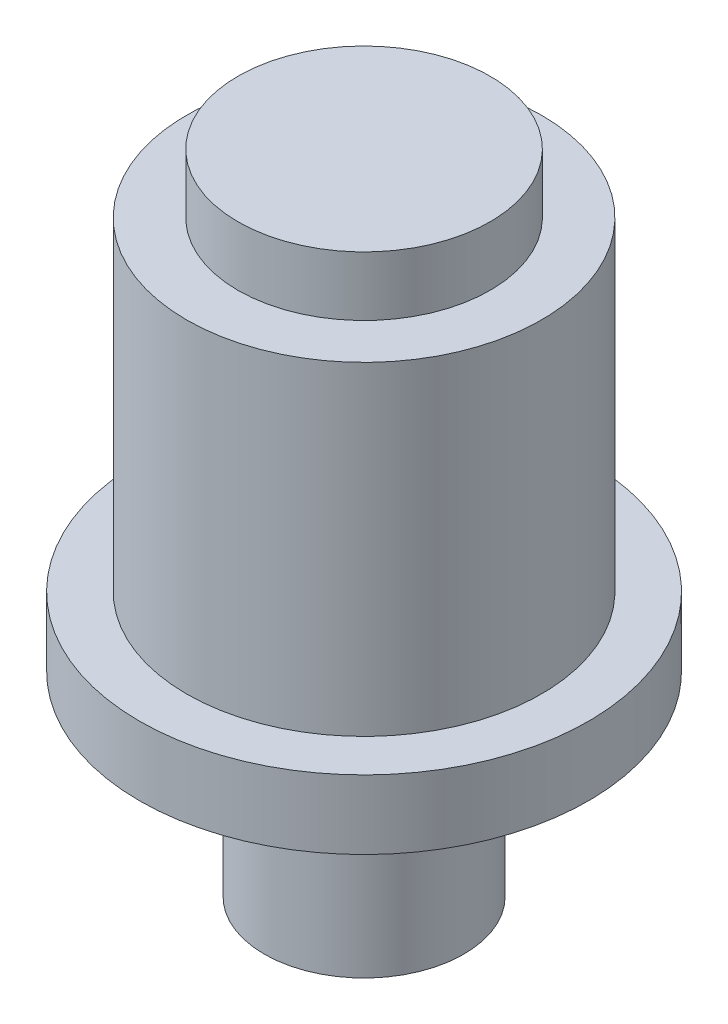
SolidWorks part; units mm, degrees
ref_plane "Ebene vorne" through (0, 0, 0) normal (0, 0, 1) x (1, 0, 0)
ref_plane "Ebene oben" through (0, 0, 0) normal (0, 1, 0) x (1, 0, 0)
ref_plane "Ebene rechts" through (0, 0, 0) normal (1, 0, 0) x (0, 0, -1)
imported_body "Importiert1"
other "Fläche löschen1"
